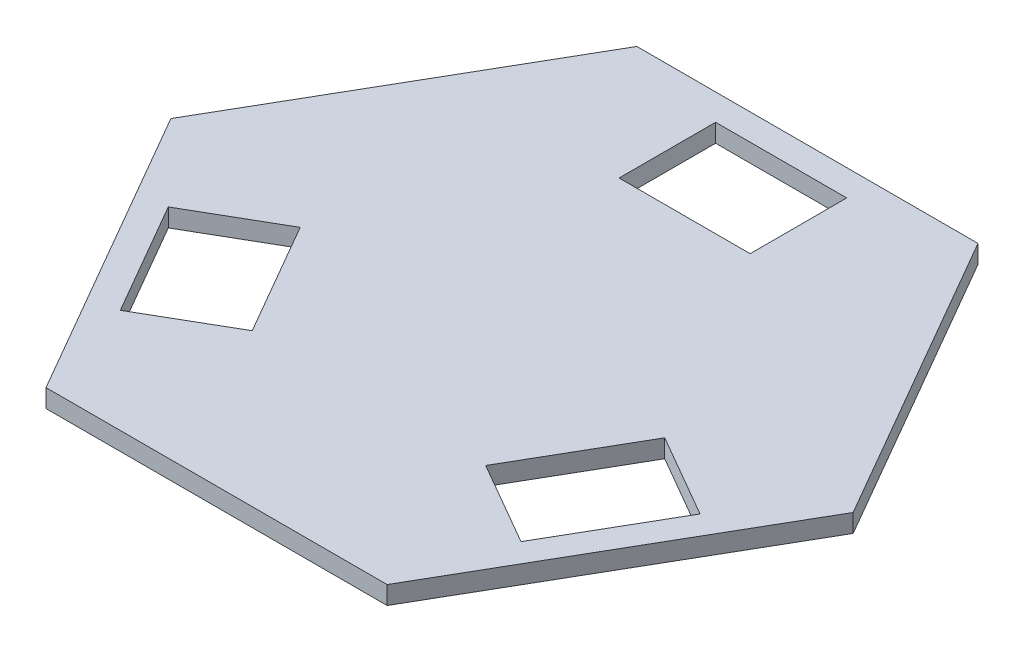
SolidWorks part; units mm, degrees
ref_plane "Front Plane" through (0, 0, 0) normal (0, 0, 1) x (1, 0, 0)
ref_plane "Top Plane" through (0, 0, 0) normal (0, 1, 0) x (1, 0, 0)
ref_plane "Right Plane" through (0, 0, 0) normal (1, 0, 0) x (0, 0, -1)
sketch "Sketch1" plane through (0, 0, 0) normal (0, 1, 0) x (1, 0, 0)
  line L0 (0, 32.5) -> (-28.1458, -16.25) construction
  line L1 (37.5278, 0) -> (18.7639, 32.5)
  line L2 (18.7639, 32.5) -> (-18.7639, 32.5)
  line L3 (-18.7639, 32.5) -> (-37.5278, 0)
  line L4 (-37.5278, 0) -> (-18.7639, -32.5)
  line L5 (-18.7639, -32.5) -> (18.7639, -32.5)
  line L6 (18.7639, -32.5) -> (37.5278, 0)
  line L7 (-28.1458, -16.25) -> (28.1458, -16.25) construction
  line L8 (28.1458, -16.25) -> (0, 32.5) construction
  line L9 (0, 24.3) -> (-21.0444, -12.15) construction
  line L10 (-21.0444, -12.15) -> (21.0444, -12.15) construction
  line L11 (21.0444, -12.15) -> (0, 24.3) construction
  line L12 (22.0391, -21.0488) -> (29.2483, -8.562)
  line L27 (7.2092, 29.6108) -> (-7.2092, 29.6108)
  line L28 (7.2092, 29.6108) -> (7.2092, 18.9892)
  line L29 (7.2092, 18.9892) -> (-7.2092, 18.9892)
  line L30 (-7.2092, 29.6108) -> (-7.2092, 18.9892)
  line L31 (7.2092, 29.6108) -> (-7.2092, 18.9892) construction
  line L32 (7.2092, 18.9892) -> (-7.2092, 29.6108) construction
  line L33 (22.0391, -21.0488) -> (12.8405, -15.738)
  line L34 (12.8405, -15.738) -> (20.0498, -3.2512)
  line L35 (29.2483, -8.562) -> (20.0498, -3.2512)
  line L36 (-29.2483, -8.562) -> (-22.0391, -21.0488)
  line L37 (-29.2483, -8.562) -> (-20.0498, -3.2512)
  line L38 (-20.0498, -3.2512) -> (-12.8405, -15.738)
  line L39 (-22.0391, -21.0488) -> (-12.8405, -15.738)
  circle A0 centre (0, 0) radius 32.5 construction
  point P29 (0, 0)
  point P37 (0, 0)
extrude "Boss-Extrude1" add sketch "Sketch1" along normal blind 2
equation "\"thkness\"= 2mm"
equation "\"size\"= 65mm"
equation "\"side_len\"= \"size\" / (2 * sin ( 60 ) )"
equation "\"D1@Sketch1\"=\"size\""
